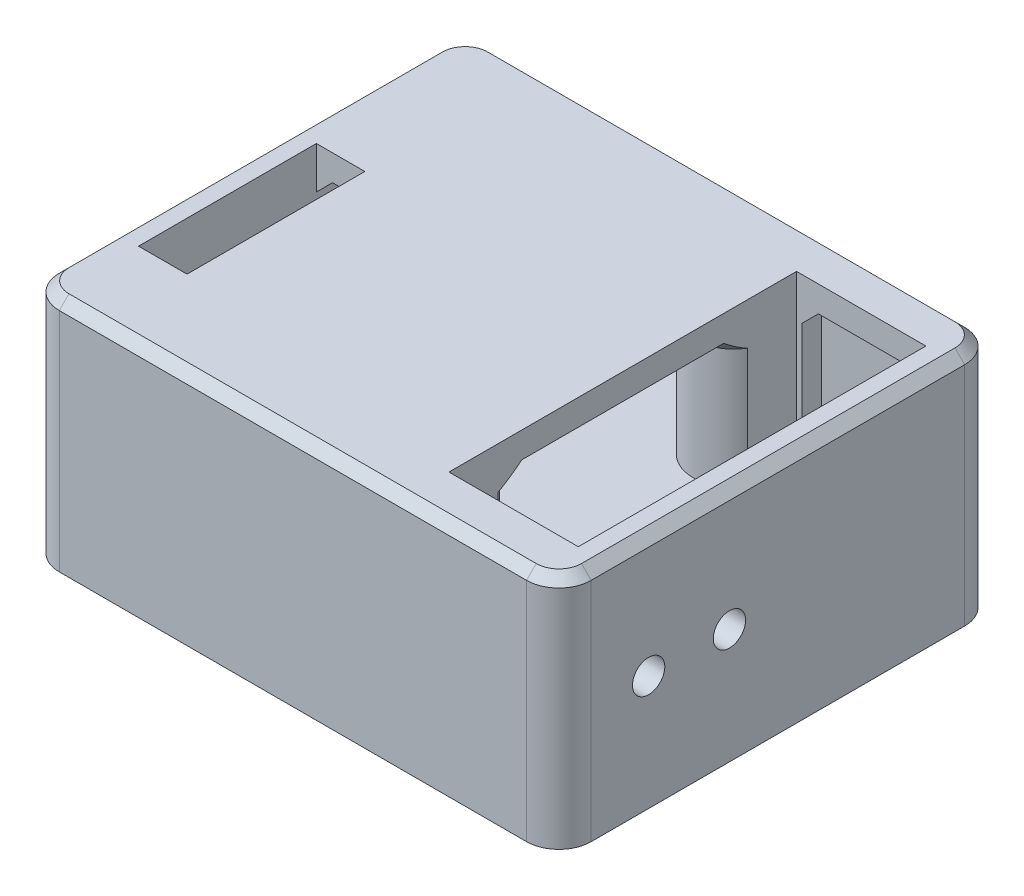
SolidWorks part; units mm, degrees
ref_plane "Přední rovina" through (0, 0, 0) normal (0, 0, 1) x (1, 0, 0)
ref_plane "Horní rovina" through (0, 0, 0) normal (0, 1, 0) x (1, 0, 0)
ref_plane "Pravá rovina" through (0, 0, 0) normal (1, 0, 0) x (0, 0, -1)
sketch "Skica1" plane through (0, 0, 0) normal (0, 1, 0) x (1, 0, 0)
  line L1 (-14.6, -11.7) -> (14.6, -11.7)
  line L2 (-14.6, -11.7) -> (-14.6, 11.7)
  line L3 (-14.6, 11.7) -> (14.6, 11.7)
  line L4 (14.6, -11.7) -> (14.6, 11.7)
  line L5 (-14.6, -11.7) -> (14.6, 11.7) construction
  line L6 (-14.6, 11.7) -> (14.6, -11.7) construction
  point P0 (0, 0)
  dimension "D1" = 29.2
  dimension "D2" = 23.4
extrude "Přidat vysunutím1" add sketch "Skica1" against normal blind 1.2
sketch "Skica2" plane through (0, 0, 0) normal (0, 1, 0) x (1, 0, 0)
  line L0 (-21.9814, 0) -> (34.0148, 0) construction
  line L1 (-14.6, 11.7) -> (-14.6, -11.7) construction
  circle A0 centre (-8.6, 9) radius 1.5
  circle A1 centre (4.7, 9) radius 1.5
  circle A2 centre (4.7, -9) radius 1.5
  circle A3 centre (-8.6, -9) radius 1.5
  dimension "D1" = 3
  dimension "D2" = 13.3
  dimension "D3" = 6
  dimension "D4" = 18
extrude "Odebrat vysunutím1" cut sketch "Skica2" against normal through all
ref_point "Bod1"
ref_plane "Rovina1" through (-8.6, 0, 0) normal (-1, 0, 0) x (0, 0, 1)
sketch "Skica3" plane through (0, 0, 0) normal (0, 1, 0) x (1, 0, 0)
  line L8 (14.85, -11.95) -> (14.85, 11.95)
  line L9 (14.85, 11.95) -> (-14.85, 11.95)
  line L10 (-14.85, 11.95) -> (-14.85, -11.95)
  line L11 (-14.85, -11.95) -> (14.85, -11.95)
  line L12 (14.85, -11.95) -> (14.85, 11.95)
  line L13 (14.85, 11.95) -> (-14.85, 11.95)
  line L14 (-14.85, 11.95) -> (-14.85, -11.95)
  line L15 (-14.85, -11.95) -> (14.85, -11.95)
  dimension "D1" = 0.25
extrude "Vysunout tenkostěnný1" add sketch "Skica3" against normal blind 4.6 and the other way blind 10 separate body thin
sketch "Skica4" plane through (0, 10, 0) normal (0, 1, 0) x (1, 0, 0)
  line L4 (-16.45, -13.55) -> (16.45, -13.55)
  line L5 (16.45, -13.55) -> (16.45, 13.55)
  line L6 (16.45, 13.55) -> (-16.45, 13.55)
  line L7 (-16.45, 13.55) -> (-16.45, -13.55)
  line L8 (-16.45, -13.55) -> (16.45, -13.55)
  line L9 (16.45, -13.55) -> (16.45, 13.55)
  line L10 (16.45, 13.55) -> (-16.45, 13.55)
  line L11 (-16.45, 13.55) -> (-16.45, -13.55)
  dimension "D1" = 0
extrude "Přidat vysunutím2" add sketch "Skica4" against normal blind 1.6
sketch "Skica6" plane through (0, 8.4, 0) normal (0, -1, 0) x (1, 0, 0)
  line L0 (-19.8878, 0) -> (22.1496, 0) construction
  line L1 (-11.1, 9) -> (-11.1, 11.95)
  line L2 (-14.85, 11.95) -> (14.85, 11.95) construction
  line L3 (-11.1, 11.95) -> (-6.1, 11.95)
  line L4 (-14.85, 11.95) -> (14.85, 11.95) construction
  line L5 (-6.1, 11.95) -> (-6.1, 9)
  line L6 (2.2, 9) -> (2.2, 11.95)
  line L7 (2.2, 11.95) -> (7.2, 11.95)
  line L8 (7.2, 11.95) -> (7.2, 9)
  line L9 (7.2, -11.95) -> (7.2, -9)
  line L10 (2.2, -11.95) -> (7.2, -11.95)
  line L11 (2.2, -9) -> (2.2, -11.95)
  line L12 (-6.1, -11.95) -> (-6.1, -9)
  line L13 (-11.1, -11.95) -> (-6.1, -11.95)
  line L14 (-11.1, -9) -> (-11.1, -11.95)
  arc A0 (-11.1, 9) -> (-6.1, 9) centre (-8.6, 9) ccw
  arc A1 (2.2, 9) -> (7.2, 9) centre (4.7, 9) ccw
  circle A2 centre (-8.6, 9) radius 1.35
  circle A3 centre (4.7, 9) radius 1.35
  circle A4 centre (4.7, -9) radius 1.35
  circle A5 centre (-8.6, -9) radius 1.35
  arc A6 (2.2, -9) -> (7.2, -9) centre (4.7, -9) cw
  arc A7 (-11.1, -9) -> (-6.1, -9) centre (-8.6, -9) cw
  dimension "D1" = 2.5
  dimension "D2" = 2.7
extrude "Přidat vysunutím3" add sketch "Skica6" along normal blind 8.4
chamfer "Zkosení1" distance 1 angle 45 24 edges at (-14.85, 1.9, 11.95) (-14.85, 1.9, -11.95) (14.85, 1.9, -11.95) (14.85, 1.9, 11.95) (-12.975, 8.4, -11.95) (-14.85, 8.4, 0) (-12.975, 8.4, 11.95) (-11.1, 8.4, 10.475) (-8.6, 8.4, 6.5) (-6.1, 8.4, 10.475) (-1.95, 8.4, 11.95) (2.2, 8.4, 10.475) (4.7, 8.4, 6.5) (7.2, 8.4, 10.475) (11.025, 8.4, 11.95) (-11.1, 8.4, -10.475) (-8.6, 8.4, -6.5) (-6.1, 8.4, -10.475) (-1.95, 8.4, -11.95) (2.2, 8.4, -10.475) (4.7, 8.4, -6.5) (7.2, 8.4, -10.475) (11.025, 8.4, -11.95) (14.85, 8.4, 0)
sketch "Skica5" plane through (0, 10, 0) normal (0, 1, 0) x (1, 0, 0)
  line L0 (-1.7929, 0) -> (20.8256, 0) construction
  line L1 (14.85, -11.95) -> (14.85, 11.95) construction
  line L2 (6.85, -10.75) -> (14.85, -10.75)
  line L3 (6.85, -10.75) -> (6.85, 10.75)
  line L4 (6.85, 10.75) -> (14.85, 10.75)
  line L5 (14.85, -10.75) -> (14.85, 10.75)
  line L6 (6.85, -10.75) -> (14.85, 10.75) construction
  line L7 (6.85, 10.75) -> (14.85, -10.75) construction
  line L8 (-14.85, 11.95) -> (-14.85, -11.95) construction
  line L9 (-14.85, -8.25) -> (-11.85, -8.25)
  line L10 (-14.85, -8.25) -> (-14.85, 2.75)
  line L11 (-14.85, 2.75) -> (-11.85, 2.75)
  line L12 (-11.85, -8.25) -> (-11.85, 2.75)
  line L13 (-14.85, -8.25) -> (-11.85, 2.75) construction
  line L14 (-14.85, 2.75) -> (-11.85, -8.25) construction
  point P3 (10.85, 0)
  point P10 (-13.35, -2.75)
  dimension "D1" = 21.5
  dimension "D2" = 8
  dimension "D3" = 11
  dimension "D4" = 3
  dimension "D5" = 2.75
extrude "Odebrat vysunutím2" cut sketch "Skica5" against normal up to next
fillet "Zaoblit1" radius 2 4 edges at (-16.45, 2.7, -13.55) (16.45, 2.7, -13.55) (-16.45, 2.7, 13.55) (16.45, 2.7, 13.55)
chamfer "Zkosení2" distance 0.6 angle 45 8 edges at (0, 10, 13.55) (15.8642, 10, 12.9642) (-15.8642, 10, 12.9642) (16.45, 10, 0) (-16.45, 10, 0) (15.8642, 10, -12.9642) (-15.8642, 10, -12.9642) (0, 10, -13.55)
sketch "Skica7" plane through (14.85, 0, 0) normal (-1, 0, 0) x (0, 0, 1)
  line L0 (-11.95, 0) -> (11.95, 0) construction
  line L2 (7.7243, 0) -> (10.75, 0) construction
  line L3 (-0.6463, 2.5) -> (10.2291, 2.5) construction
  line L5 (0, 0) -> (0, -2.1324) construction
  line L6 (-11.95, 7.4) -> (-11.95, -4.6) construction
  line L7 (11.95, 7.4) -> (11.95, -4.6) construction
  circle A0 centre (3, 2.5) radius 1
  circle A1 centre (8, 2.5) radius 1
  dimension "D1" = 2
  dimension "D2" = 5
  dimension "D3" = 3
  dimension "D4" = 2.5
extrude "Odebrat vysunutím3" cut sketch "Skica7" against normal through all
sketch "Skica8" plane through (0, -4.6, 0) normal (0, -1, 0) x (1, 0, 0)
  line L4 (14.6, 11.7) -> (-14.6, 11.7)
  line L5 (14.6, -11.7) -> (14.6, 11.7)
  line L6 (-14.6, -11.7) -> (14.6, -11.7)
  line L7 (-14.6, 11.7) -> (-14.6, -11.7)
  line L8 (14.6, 11.7) -> (-14.6, 11.7)
  line L9 (14.6, -11.7) -> (14.6, 11.7)
  line L10 (-14.6, -11.7) -> (14.6, -11.7)
  line L11 (-14.6, 11.7) -> (-14.6, -11.7)
  dimension "D1" = 0
extrude "Přidat vysunutím4" add sketch "Skica8" against normal blind 1.6 separate body
sketch "Skica9" plane through (0, -3, 0) normal (0, 1, 0) x (1, 0, 0)
  line L0 (14.6, -11.7) -> (-14.6, -11.7) construction
  line L1 (-11.6, -11.7) -> (8.6, -11.7)
  line L2 (-11.6, -11.7) -> (-11.6, 11.7)
  line L3 (-11.6, 11.7) -> (8.6, 11.7)
  line L4 (8.6, -11.7) -> (8.6, 11.7)
  line L5 (-14.6, 11.7) -> (14.6, 11.7) construction
  line L6 (-14.6, -11.7) -> (-14.6, 11.7) construction
  line L7 (14.6, 11.7) -> (14.6, -11.7) construction
  circle A0 centre (-8.6, 9) radius 1.6
  circle A1 centre (4.7, 9) radius 1.6
  circle A2 centre (4.7, -9) radius 1.6
  circle A3 centre (-8.6, -9) radius 1.6
  dimension "D1" = 3.2
  dimension "D2" = 3
  dimension "D3" = 6
extrude "Přidat vysunutím5" add sketch "Skica9" along normal blind 1.6
sketch "Skica10" plane through (0, -3, 0) normal (0, 1, 0) x (1, 0, 0)
  circle A0 centre (4.7, 9) radius 1.6 construction
  circle A1 centre (-8.6, 9) radius 1.6 construction
  circle A2 centre (-8.6, -9) radius 1.6 construction
  circle A3 centre (4.7, -9) radius 1.6 construction
  circle A4 centre (4.7, 9) radius 1.6
  circle A5 centre (-8.6, 9) radius 1.6
  circle A6 centre (-8.6, -9) radius 1.6
  circle A7 centre (4.7, -9) radius 1.6
extrude "Odebrat vysunutím4" cut sketch "Skica10" against normal through all
delete or keep bodies "Tělo-Odstranit1" [suppressed] type delete bodies bodies 107
delete or keep bodies "Tělo-Odstranit2" [suppressed] type delete bodies bodies 110
delete or keep bodies "Tělo-Odstranit3" [suppressed] type delete bodies bodies 102
